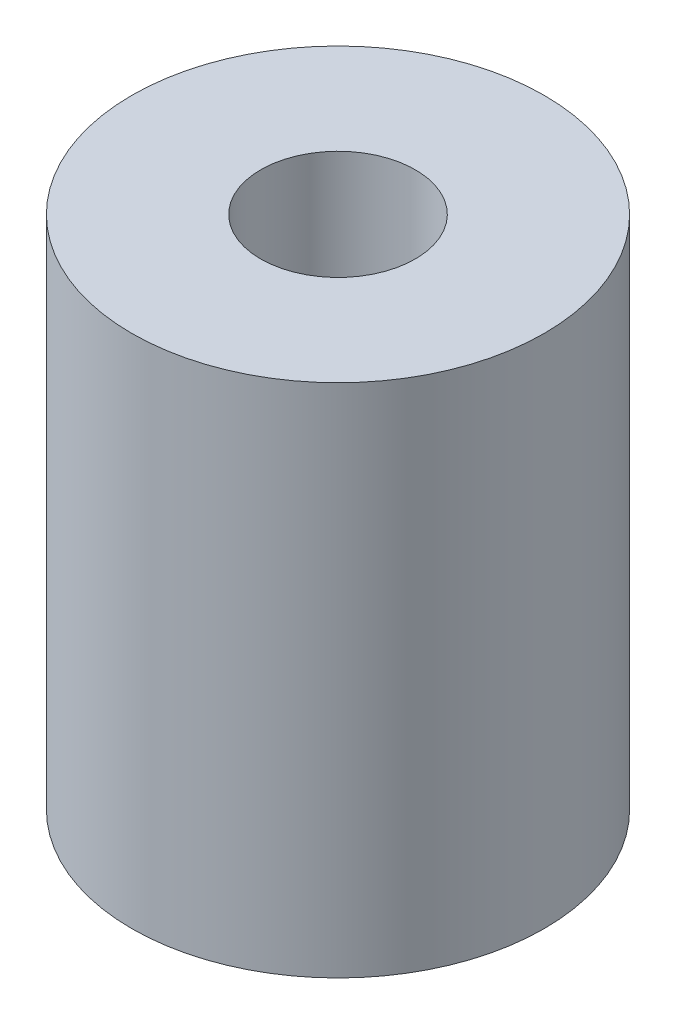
SolidWorks part; units mm, degrees
ref_plane "Front Plane" through (0, 0, 0) normal (0, 0, 1) x (1, 0, 0)
ref_plane "Top Plane" through (0, 0, 0) normal (0, 1, 0) x (1, 0, 0)
ref_plane "Right Plane" through (0, 0, 0) normal (1, 0, 0) x (0, 0, -1)
sketch "Sketch1" plane through (0, 0, 0) normal (0, 1, 0) x (1, 0, 0)
  circle A0 centre (0, 0) radius 4
  dimension "D1" = 8
extrude "Extrude1" add sketch "Sketch1" along normal blind 10
sketch "Sketch7" plane through (0, 0, 0) normal (0, -1, 0) x (1, 0, 0)
  circle A4 centre (0, 0) radius 3
  dimension "D1" = 6
extrude "Extrude4" add sketch "Sketch7" along normal blind 0.5
hole_wizard "M3x0.5 Tapped Hole2" positions "3DSketch3" profile "Sketch6" tap size "M3x0.5" standard "Ansi Metric"
sketch3d "3DSketch3"
  line L0 (0, 10, 0) -> (0, 0, 0) construction
  point P12 (0, 10, 0)
sketch "Sketch6" plane through (0, 10, 0) normal (1, 0, 0) x (0, 0, 1)
  line L0 (0, 0) -> (0, 10.5)
  line L1 (0, 10.5) -> (1.25, 10.5)
  line L3 (1.25, 10.5) -> (1.25, 6)
  line L4 (1.25, 6) -> (1.5, 6)
  line L5 (1.5, 6) -> (1.5, 0)
  line L7 (1.5, 0) -> (0, 0)
  line L11 (0, -6.35) -> (0, 107.95) construction
  dimension "Thru Tap Drill Dia." = 2.5
  dimension "Thru Tap Drill Depth" = 10.5
  dimension "Thread Major Dia." = 3
  dimension "Thread Depth" = 6
hole_wizard "M3x0.5 Tapped Hole3" positions "3DSketch4" profile "Sketch9" tap size "M3x0.5" standard "Ansi Metric"
sketch3d "3DSketch4"
  point P0 (0, 5.5, -4)
  dimension "D1" = 4.5
sketch "Sketch9" plane through (0, 5.5, -4) normal (1, 0, 0) x (0, 1, 0)
  line L0 (0, 0) -> (0, 6.7511)
  line L1 (0, 6.7511) -> (1.25, 6)
  line L2 (1.25, 6) -> (1.25, 0)
  line L5 (1.25, 0) -> (0, 0)
  line L10 (0, 6.7511) -> (-1.25, 6) construction
  line L11 (0, -6.35) -> (0, 107.95) construction
  dimension "Tap Drill Dia." = 2.5
  dimension "Tap Drill Depth" = 6
  dimension "Drill Angle" = 118
hole_wizard "Ø3.0 (3) Diameter Hole1" positions "3DSketch5" profile "Sketch13" hole size "Ø3.0" standard "Ansi Metric"
sketch3d "3DSketch5"
  circle A0 centre (0, -0.5, 0) radius 3 construction
  point P0 (0, -0.5, 0)
  point P6 (0, -3.5, 0)
sketch "Sketch13" plane through (0, -0.5, 0) normal (1, 0, 0) x (0, 0, -1)
  line L0 (0, 0) -> (0, 8.9013)
  line L1 (0, 8.9013) -> (1.5, 8)
  line L2 (1.5, 8) -> (1.5, 0)
  line L5 (1.5, 0) -> (0, 0)
  line L10 (0, 8.9013) -> (-1.5, 8) construction
  line L11 (0, -6.35) -> (0, 107.95) construction
  dimension "Hole Dia." = 3
  dimension "Hole Depth" = 8
  dimension "Drill Angle" = 118
ref_plane "Plane2" [suppressed] through (0, 5.8093, 0) normal (0, 1, 0) x (-1, 0, 0)
sketch "Sketch12" [suppressed] plane through (0, 5.8093, 0) normal (0, 1, 0) x (-1, 0, 0)
  line L1 (-3.35, -2.1857) -> (3.35, -2.1857)
  line L2 (-3.35, -2.1857) -> (-3.35, -8.1409)
  line L3 (-3.35, -8.1409) -> (3.35, -8.1409)
  line L4 (3.35, -2.1857) -> (3.35, -8.1409)
  circle A0 centre (0, 0) radius 4 construction
  dimension "D1" = 6.7
extrude "Cut-Extrude3" [suppressed] cut sketch "Sketch12" against normal blind 6 and the other way through all
